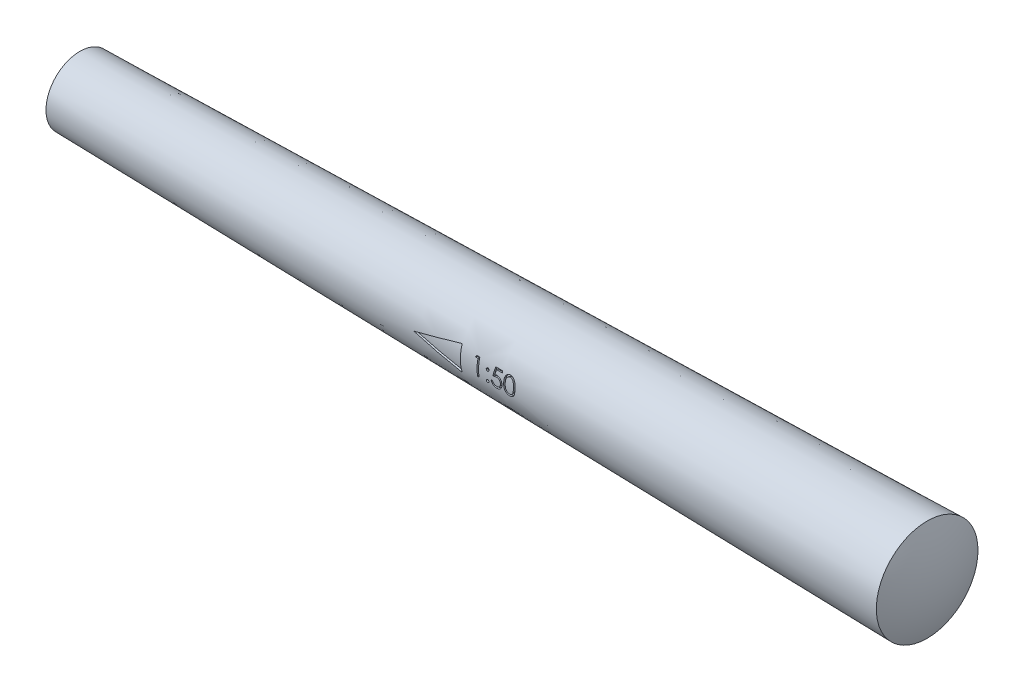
SolidWorks part; units mm, degrees
ref_plane "Front Plane" through (0, 0, 0) normal (0, 0, 1) x (1, 0, 0)
ref_plane "Top Plane" through (0, 0, 0) normal (0, 1, 0) x (1, 0, 0)
ref_plane "Right Plane" through (0, 0, 0) normal (1, 0, 0) x (0, 0, -1)
sketch "Sketch1" plane through (0, 0, 0) normal (1, 0, 0) x (0, 0, -1)
  circle A0 centre (0, 0) radius 2
  dimension "D1" = 4
extrude "Extrude1" add sketch "Sketch1" along normal mid plane 50
draft "Draft1" type of draft neutral plane draft angle 1.146 faces to draft 1 parameters "D1"=1.146
sketch "Sketch2" plane through (0, 0, 0) normal (0, 0, 1) x (1, 0, 0)
  line L0 (-25, 0) -> (-25, 2)
  line L1 (-25, 2) -> (-25, -2) construction
  line L2 (-25, 0) -> (-25.6, 0)
  line L3 (-25.6, 0) -> (-25.6, -2.5) construction
  line L4 (25, 0) -> (25, 3)
  line L5 (25, -3) -> (25, 3) construction
  line L6 (25, 0) -> (25.6, 0)
  line L7 (25.6, 0) -> (25.6, -2.5) construction
  line L8 (-25, -2) -> (25, -3) construction
  arc A0 (-25.6, 0) -> (-25, 2) centre (-21.9667, 0) cw
  arc A1 (25.6, 0) -> (25, 3) centre (17.7998, 0) ccw
  point P14 (0, -2.5)
revolve "Revolve1" add sketch "Sketch2" angle 360 about L2
sketch "Sketch5" plane through (0, 0, 0) normal (0, 0, 1) x (1, 0, 0)
  line L0 (0, 2.5) -> (0, -2.5) construction
  line L1 (25, 3) -> (-25, 2) construction
  line L2 (-25, -2) -> (25, -3) construction
ref_plane "Plane2" through (0, 0, 0) normal (-0.02, 0, 0.9998) x (0.9998, 0, 0.02)
sketch "Sketch6" plane through (0, 0, 0) normal (-0.02, 0, 0.9998) x (0.9998, 0, 0.02)
  line L0 (0, 0) -> (0, 0.75)
  line L1 (0, 2.5) -> (0, -2.5) construction
  line L2 (0, 0.75) -> (-2.799, 0)
  line L3 (-2.799, 0) -> (0, -0.75)
  line L4 (0, -0.75) -> (0, 0)
  line L5 (0, -0.375) -> (4, -0.375) construction
  text T0 "1:50" font "Century Gothic" height 1
  dimension "D1" = 1.5
  dimension "D2" = 30
  dimension "D3" = 4
wrap "Wrap2" sketch "Sketch6" wrap type deboss source sketch "Sketch6" thickness 0.1 parameters "D1"=0.1
equation "\"D2@Sketch2\" = \"D1@Sketch2\""
